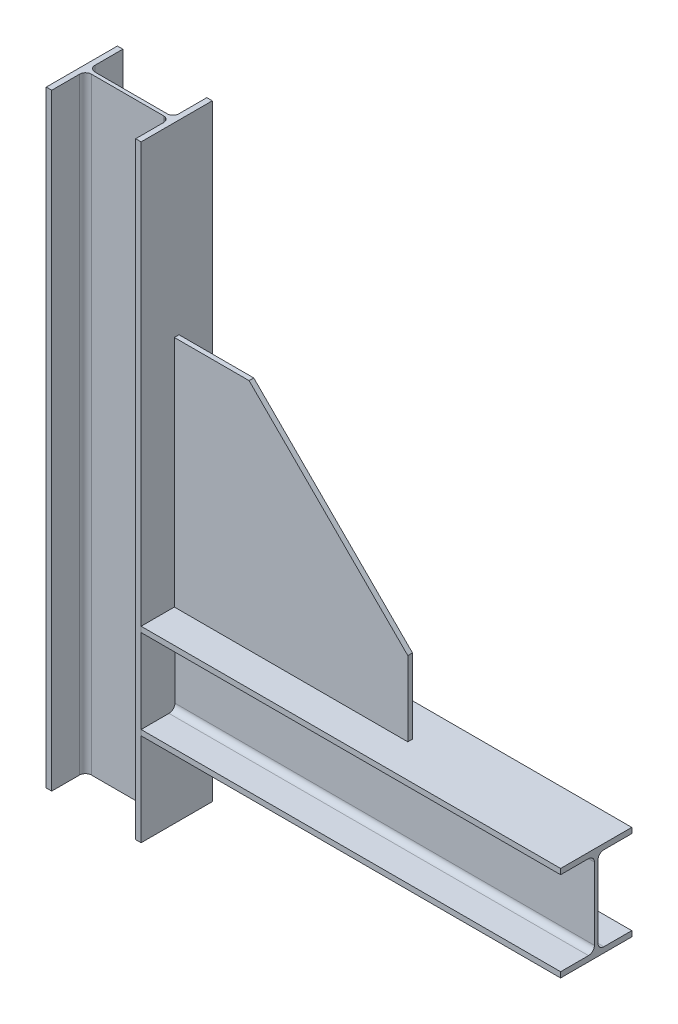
SolidWorks part; units mm, degrees
ref_plane "Front Plane" through (0, 0, 0) normal (0, 0, 1) x (1, 0, 0)
ref_plane "Top Plane" through (0, 0, 0) normal (0, 1, 0) x (1, 0, 0)
ref_plane "Right Plane" through (0, 0, 0) normal (1, 0, 0) x (0, 0, -1)
sketch "Sketch1" plane through (0, 0, 0) normal (0, 0, 1) x (1, 0, 0)
  line L0 (0, 500) -> (0, -150)
  line L1 (0, 0) -> (500, 0)
  dimension "D1" = 500
  dimension "D2" = 500
  dimension "D3" = 150
ref_plane "Plane1" through (0, 500, 0) normal (0, -1, 0) x (1, 0, 0)
ref_plane "Plane2" through (0, 500, 0) normal (0, -1, 0) x (1, 0, 0)
other "Al i beam AL I BEAM 4X2.31(1)"
ref_plane "Plane3" through (0, 500, 0) normal (0, -1, 0) x (0, 0, 1)
sketch "Sketch12" plane through (0, 500, 0) normal (0, -1, 0) x (0, 0, 1)
  line L0 (-38.1, -50.8) -> (-38.1, -44.958)
  line L1 (-38.1, -44.958) -> (-8.255, -44.958)
  line L2 (-1.905, -38.608) -> (-1.905, 38.608)
  line L3 (-8.255, 44.958) -> (-38.1, 44.958)
  line L4 (-38.1, 44.958) -> (-38.1, 50.8)
  line L5 (-38.1, 50.8) -> (38.1, 50.8)
  line L6 (38.1, 50.8) -> (38.1, 44.958)
  line L7 (38.1, 44.958) -> (8.255, 44.958)
  line L8 (1.905, 38.608) -> (1.905, -38.608)
  line L9 (8.255, -44.958) -> (38.1, -44.958)
  line L10 (38.1, -44.958) -> (38.1, -50.8)
  line L11 (38.1, -50.8) -> (-38.1, -50.8)
  line L12 (1.905, 0) -> (-1.905, 0) construction
  arc A0 (-8.255, -44.958) -> (-1.905, -38.608) centre (-8.255, -38.608) ccw
  arc A1 (-1.905, 38.608) -> (-8.255, 44.958) centre (-8.255, 38.608) ccw
  arc A2 (8.255, 44.958) -> (1.905, 38.608) centre (8.255, 38.608) ccw
  arc A3 (1.905, -38.608) -> (8.255, -44.958) centre (8.255, -38.608) ccw
  point P20 (0, 50.8)
  point P23 (0.282, 0)
  point P25 (0, -50.8)
  point P26 (0, 0)
  point P27 (0, 0)
  dimension "Ri" = 6.35
  dimension "Tw" = 3.81
  dimension "Bf" = 76.2
  dimension "Depth" = 101.6
  dimension "Tf" = 5.842
other "Gusset1" parameters "D1"=5, "D2"=5, "D3"=0, "D4"=0, "D10"=5, "D11"=250, "D12"=250, "D13"=80, "D14"=45, "D15"=80, "D16"=125, "D17"=125, "D18"=45
sketch "Sketch13" plane through (50.8, 50.8, 0) normal (0, 0, 1) x (1, 0, 0)
  line L0 (0, 0) -> (0, 250)
  line L1 (0, 0) -> (250, 0)
  line L2 (80, 250) -> (250, 80)
  line L3 (0, 250) -> (80, 250)
  line L4 (250, 0) -> (250, 80)
